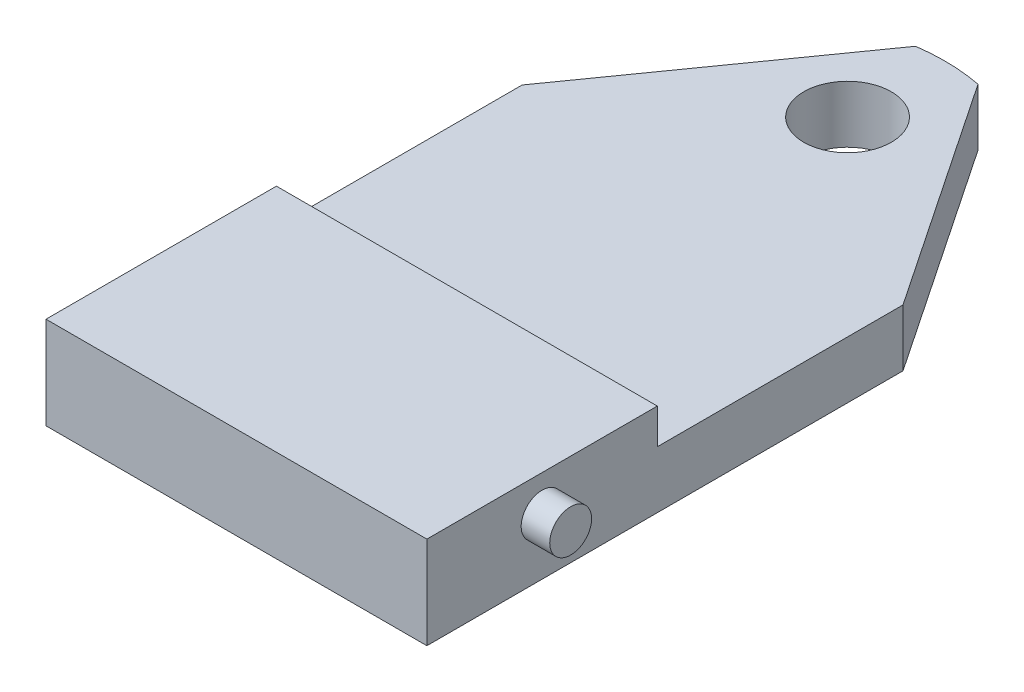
SolidWorks part; units mm, degrees
ref_plane "Front Plane" through (0, 0, 0) normal (0, 0, 1) x (1, 0, 0)
ref_plane "Top Plane" through (0, 0, 0) normal (0, 1, 0) x (1, 0, 0)
ref_plane "Right Plane" through (0, 0, 0) normal (1, 0, 0) x (0, 0, -1)
sketch "Sketch1" plane through (0, 0, 0) normal (0, 1, 0) x (1, 0, 0)
  line L2 (0, -15) -> (0, -40)
  line L3 (0, -40) -> (20, -40)
  line L4 (20, -15) -> (20, -40)
  line L11 (0, -15) -> (8.5665, -2.9111)
  line L12 (20, -15) -> (11.9329, -2.9947)
  circle A0 centre (10, -7.9118) radius 2.3
  arc A3 (8.5665, -2.9111) -> (11.9329, -2.9947) centre (10, -13.0066) cw
  dimension "D5" = 4.6
  dimension "D1" = 20
  dimension "D2" = 25
extrude "Boss-Extrude1" add sketch "Sketch1" along normal blind 3
sketch "Sketch2" plane through (20, 0, 0) normal (1, 0, 0) x (0, 0, -1)
  line L0 (-40, 3) -> (-40, 4.85)
  line L1 (-40, 4.85) -> (-27.9, 4.85)
  line L2 (-27.9, 4.85) -> (-27.9, 3)
  line L3 (-40, 3) -> (-15, 3) construction
  line L4 (-40, 3) -> (-27.9, 3)
  line L5 (-40, 0) -> (-15, 0) construction
  dimension "D1" = 12.1
  dimension "D2" = 4.85
extrude "Boss-Extrude3" add sketch "Sketch2" along normal up to surface (20 mm away) from surface at -20
sketch "Sketch3" plane through (20, 0, 0) normal (1, 0, 0) x (0, 0, -1)
  circle A0 centre (-33.95, 2.95) radius 1.1
  dimension "D1" = 2.2
extrude "Boss-Extrude4" add sketch "Sketch3" along normal blind 1.5
